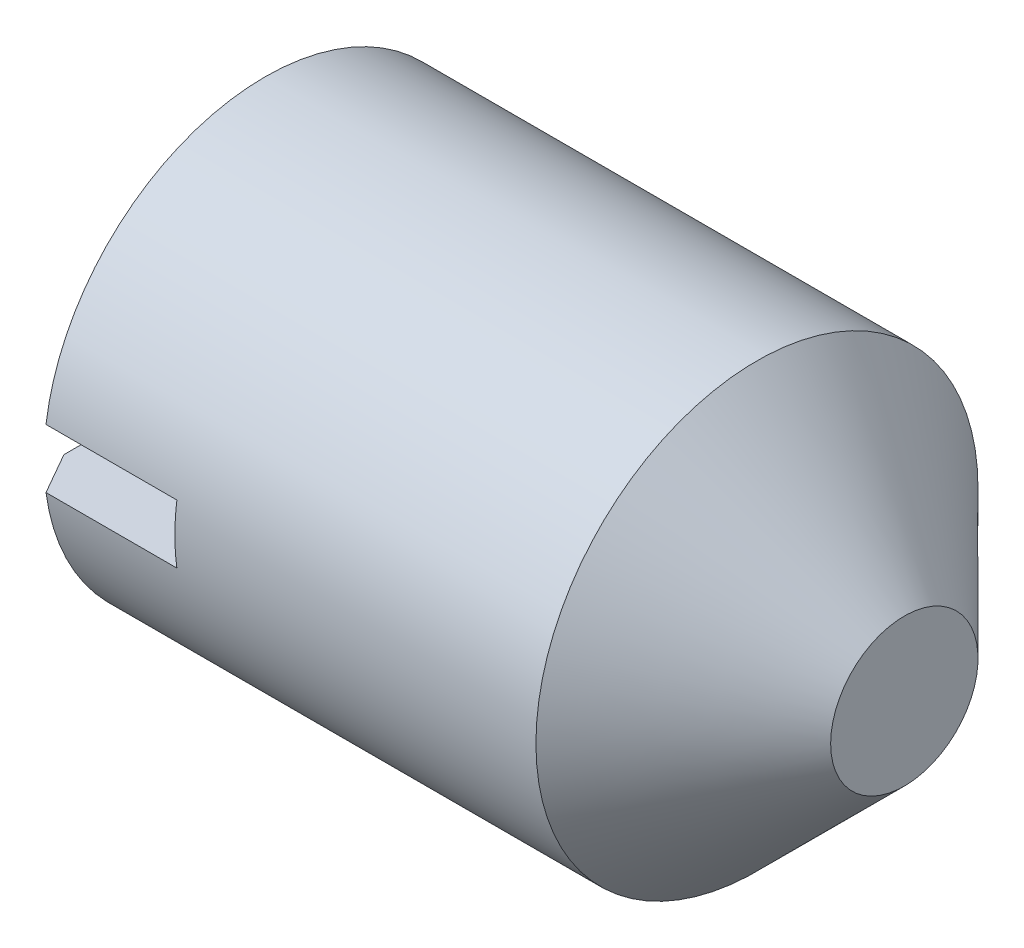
SolidWorks part; units mm, degrees
ref_plane "Plane1" through (0, 0, 0) normal (0, 0, 1) x (1, 0, 0)
ref_plane "Plane2" through (0, 0, 0) normal (0, 1, 0) x (1, 0, 0)
ref_plane "Plane3" through (0, 0, 0) normal (1, 0, 0) x (0, 0, -1)
sketch "BodySke" plane through (0, 0, 0) normal (0, 0, 1) x (1, 0, 0)
  line L0 (0, 0) -> (0, 1.2195)
  line L1 (0, 1.2195) -> (0.1619, 1.5)
  line L2 (0.1619, 1.5) -> (3.5, 1.5)
  line L3 (3.5, 1.5) -> (5, 0)
  line L4 (5, 0) -> (0, 0)
  line L5 (-12.7, 0) -> (88.9, 0) construction
  line L6 (3.5, -1.5) -> (5, 0) construction
  line L7 (0.25, 15.875) -> (0.25, -3.175) construction
  line L8 (0, -1.2195) -> (0.1619, -1.5) construction
  dimension "Cone_ang" = 90
  dimension "Length" = 5
  dimension "Diameter" = 3
  dimension "Drive_ch_ang" = 60
  dimension "Minor_dia" = 2.439
  dimension "Advance" = 0.5
revolve "BaseBody" add sketch "BodySke"
extrude "Slot" cut sketch "Sketch2" against normal blind 1.05
sketch "Sketch2" plane through (0, 0, 0) normal (-1, 0, 0) x (0, 0, 1)
  line L0 (1.5, 0.2) -> (-1.5, 0.2)
  line L1 (1.5, -0.2) -> (1.5, 0.2)
  line L2 (-1.5, -0.2) -> (-1.5, 0.2)
  line L4 (1.5, -0.2) -> (-1.5, -0.2)
  circle A2 centre (0, 0) radius 1.5 construction
  dimension "D1" = 0.2
  dimension "Slot_width" = 0.4
sketch "ThdSchSke" plane through (0, 0, 0) normal (0, 0, 1) x (1, 0, 0)
  line L0 (0.1619, -1.2195) -> (-0.0345, -1.5)
  line L1 (0.1619, -1.2195) -> (0.3584, -1.5)
  line L2 (0.3584, -1.5) -> (0.3584, -1.875)
  line L3 (-3.175, 0) -> (5.1513, 0) construction
  line L4 (0.1619, 1.5) -> (0.1619, -1.5) construction
  line L5 (0.3584, -1.875) -> (-0.0345, -1.875)
  line L6 (-0.0345, -1.875) -> (-0.0345, -1.5)
  dimension "Thread_minor" = 2.439
  dimension "Diameter" = 3
  dimension "SideAngle" = 55
  dimension "VeeAngle" = 70
  dimension "Overcut" = 3.75
revolve "ThreadSchematic" [suppressed] cut sketch "ThdSchSke" angle 360 about L3
pattern_linear "ThdSchPat" [suppressed]
sketch "Esquisse1" plane through (0, 0, 0) normal (0, 1, 0) x (1, 0, 0)
  line L1 (4.5, 0.8896) -> (5.4229, 0.8896)
  line L2 (4.5, 0.8896) -> (4.5, -1.0119)
  line L3 (4.5, -1.0119) -> (5.4229, -1.0119)
  line L4 (5.4229, 0.8896) -> (5.4229, -1.0119)
  dimension "D1" = 0.5
extrude "Enlèv. mat.-Extru.1" cut sketch "Esquisse1" against normal through all and the other way through all
equation "\"Thread_minor@ThreadCosmetic\" = \"Minor_dia@BodySke\""
equation "\"Thread_minor@ThdSchSke\" = \"Thread_minor@ThreadCosmetic\""
equation "\"Diameter@ThdSchSke\" = \"Diameter@BodySke\""
equation "\"Overcut@ThdSchSke\" = \"Diameter@BodySke\" * 1.25"
equation "\"Num_threads@ThdSchPat\" = int( (\"Length@BodySke\" - ( ( ( \"Diameter@BodySke\" - \"Minor_dia@BodySke\" ) * 0.5 ) / tan( \"Drive_ch_ang@BodySke\" * 0.017453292 ) ) - ( ( \"Diameter@BodySke\" * 0.5 ) / tan( \"Con"
equation "\"Advance@ThdSchPat\" = (\"Length@BodySke\" - ( ( ( \"Diameter@BodySke\" - \"Minor_dia@BodySke\" ) * 0.5 ) / tan( \"Drive_ch_ang@BodySke\" * 0.017453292 ) ) - ( ( \"Diameter@BodySke\" * 0.5 ) / tan( \"Cone_ang@Bod"
equation "' \"Num_threads@ThdSchPat\" = \"Num_threads@ThdSchPat\" - sgn( \"Num_threads@ThdSchPat\" - 1) '---chamfered tips only---"
equation "\"D1@Sketch2\" = \"Slot_width@Sketch2\" / 2"
